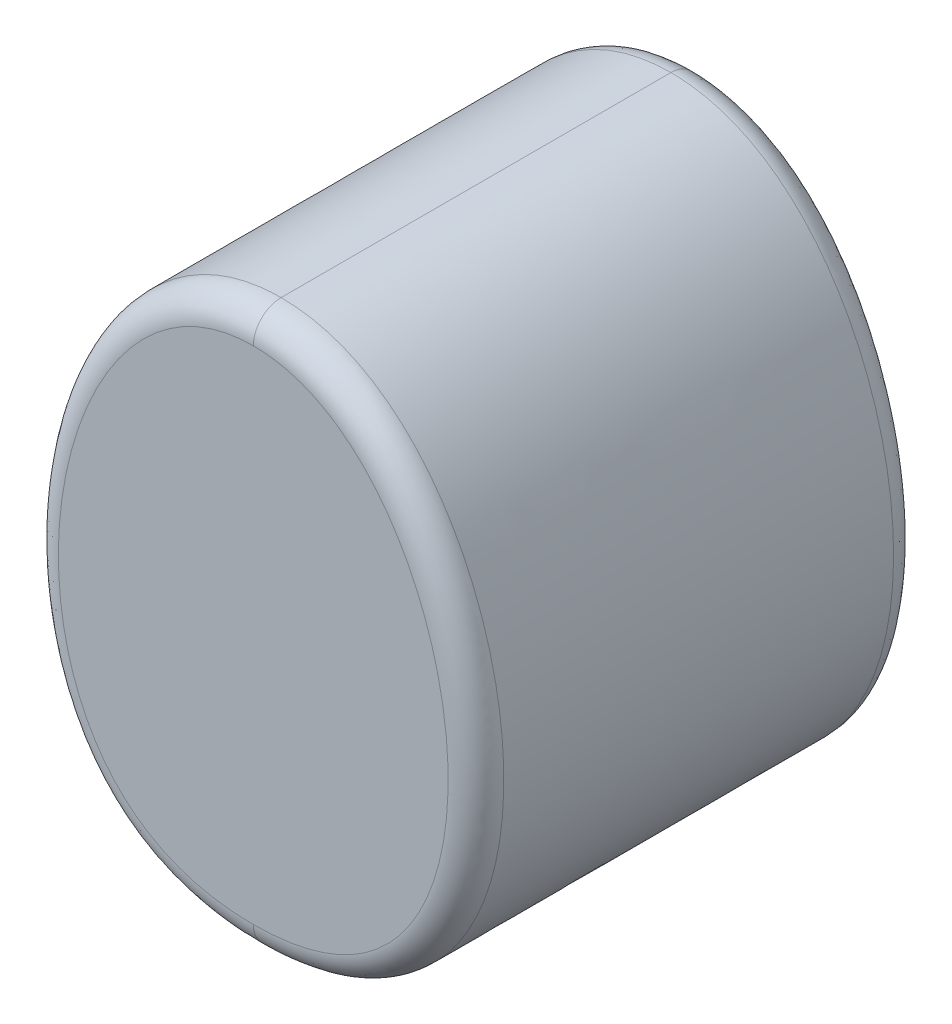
SolidWorks part; units mm, degrees
ref_plane "Front Plane" through (0, 0, 0) normal (0, 0, 1) x (1, 0, 0)
ref_plane "Top Plane" through (0, 0, 0) normal (0, 1, 0) x (1, 0, 0)
ref_plane "Right Plane" through (0, 0, 0) normal (1, 0, 0) x (0, 0, -1)
sketch "Sketch1" plane through (0, 0, 0) normal (0, 0, 1) x (1, 0, 0)
  spline S0 degree 3 poles (-169.4648, 86.5056) (-193.5866, 86.5056) (-187.8153, 126.5056) (-169.4648, 126.5056) knots 0.5 0.5 0.5 0.5 1 1 1 1
  spline S1 degree 3 poles (-169.4648, 126.5056) (-151.1143, 126.5056) (-145.343, 86.5056) (-169.4648, 86.5056) knots 0 0 0 0 0.5 0.5 0.5 0.5
extrude "Boss-Extrude1" add sketch "Sketch1" along normal blind 32
fillet "Fillet1" radius 2 4 edges
